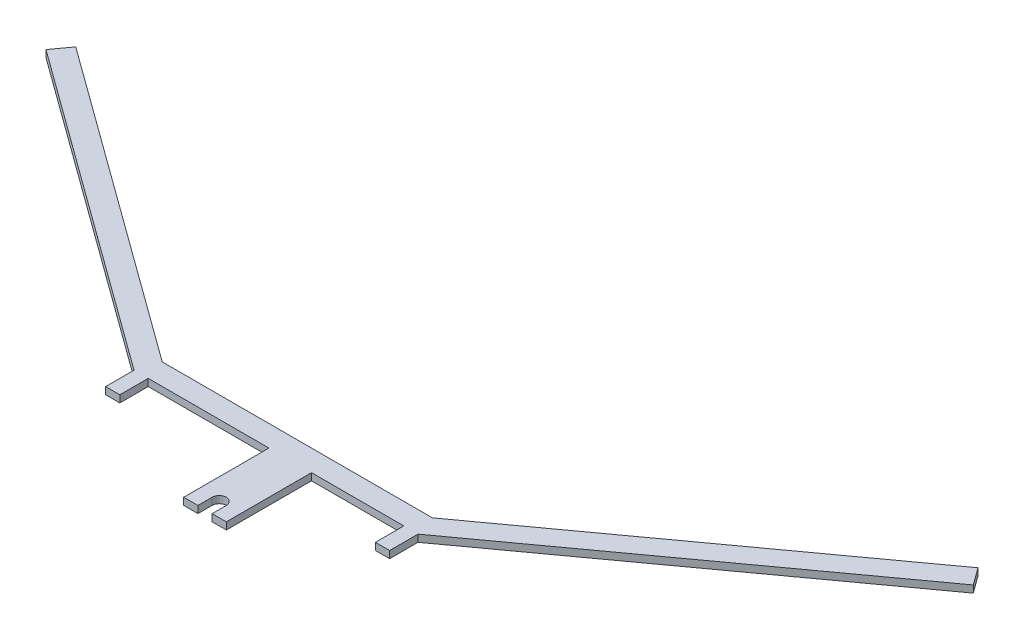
SolidWorks part; units mm, degrees
ref_plane "前视基准面" through (0, 0, 0) normal (0, 0, 1) x (1, 0, 0)
ref_plane "上视基准面" through (0, 0, 0) normal (0, 1, 0) x (1, 0, 0)
ref_plane "右视基准面" through (0, 0, 0) normal (1, 0, 0) x (0, 0, -1)
sketch "草图1" plane through (0, 0, 0) normal (0, 1, 0) x (1, 0, 0)
  line L0 (0, 0) -> (0, -51.4782) construction
  line L1 (-31.7734, -28.8317) -> (-9.5127, -45)
  line L2 (-9.5127, -45) -> (9.5127, -45)
  line L3 (-31.7734, -28.8317) -> (-32.6549, -30.0454)
  line L4 (-32.6549, -30.0454) -> (-10, -46.5)
  line L5 (-10, -46.5) -> (10, -46.5)
  line L6 (31.7734, -28.8317) -> (32.6549, -30.0454)
  line L7 (31.7734, -28.8317) -> (9.5127, -45)
  line L8 (32.6549, -30.0454) -> (10, -46.5)
  circle A0 centre (0, 0) radius 42 construction
  point P8 (0, -42)
  point P14 (0, -46.5)
  point P15 (0, -45)
  dimension "D1" = 84
  dimension "D2" = 20
  dimension "D3" = 3
  dimension "D4" = 1.5
  dimension "D5" = 1.5
  dimension "D6" = 28
extrude "凸台-拉伸1" add sketch "草图1" along normal mid plane 0.5
sketch "草图2" plane through (0, 0.25, 0) normal (0, 1, 0) x (1, 0, 0)
  line L0 (0, -45) -> (0, -49.7255) construction
  line L1 (9.5127, -45) -> (-9.5127, -45) construction
  line L2 (-10, -46.5) -> (10, -46.5) construction
  line L3 (-10, -46.5) -> (-9, -46.5)
  line L4 (-10, -46.5) -> (-10, -48.5)
  line L5 (-10, -48.5) -> (-9, -48.5)
  line L6 (-9, -46.5) -> (-9, -48.5)
  line L7 (10, -48.5) -> (9, -48.5)
  line L8 (9, -46.5) -> (9, -48.5)
  line L9 (10, -46.5) -> (9, -46.5)
  line L10 (10, -46.5) -> (10, -48.5)
  point P11 (-9.5, -48.5)
  dimension "D1" = 1
  dimension "D2" = 2
extrude "凸台-拉伸2" add sketch "草图2" against normal up to surface (0.5 mm away)
sketch "草图5" plane through (0, -0.25, 0) normal (0, -1, 0) x (1, 0, 0)
  line L1 (9, 46.5) -> (13.5371, 46.5)
  line L2 (9, 46.5) -> (9, 50.8222)
  line L3 (9, 50.8222) -> (13.5371, 50.8222)
  line L4 (13.5371, 46.5) -> (13.5371, 50.8222)
extrude "切除-拉伸1" cut sketch "草图5" against normal through all
sketch "草图6" plane through (0, -0.25, 0) normal (0, -1, 0) x (1, 0, 0)
  line L0 (-9, 46.5) -> (10, 46.5) construction
  line L1 (2.5, 46.5) -> (-0.5, 46.5)
  line L2 (2.5, 46.5) -> (2.5, 52.5)
  line L3 (2.5, 52.5) -> (-0.5, 52.5)
  line L4 (-0.5, 46.5) -> (-0.5, 52.5)
  line L5 (10, 46.5) -> (10, 49.9674) construction
  dimension "D1" = 6
  dimension "D2" = 3
  dimension "D3" = 7.5
extrude "凸台-拉伸3" add sketch "草图6" against normal up to surface (0.5 mm away)
sketch "草图7" plane through (0, -0.25, 0) normal (0, -1, 0) x (1, 0, 0)
  line L0 (1, 52.5) -> (1, 51.5) construction
  line L1 (2.5, 52.5) -> (-0.5, 52.5) construction
  line L2 (0.5, 51.5) -> (0.5, 55.2784)
  line L3 (0.5, 55.2784) -> (1.5, 55.2784)
  line L4 (1.5, 55.2784) -> (1.5, 51.5)
  arc A0 (0.5, 51.5) -> (1.5, 51.5) centre (1, 51.5) ccw
  dimension "D1" = 1
  dimension "D2" = 1
extrude "切除-拉伸2" cut sketch "草图7" against normal through all
sketch "草图8" plane through (0, -0.25, 0) normal (0, -1, 0) x (1, 0, 0)
  line L0 (10, 46.5) -> (10, 48.5)
  line L1 (10, 48.5) -> (9, 48.5)
  line L2 (9, 48.5) -> (9, 46.5)
  line L3 (2.5, 46.5) -> (10, 46.5) construction
  line L4 (9, 46.5) -> (10, 46.5)
  dimension "D1" = 1
  dimension "D2" = 2
extrude "凸台-拉伸4" add sketch "草图8" against normal up to surface (0.5 mm away)
